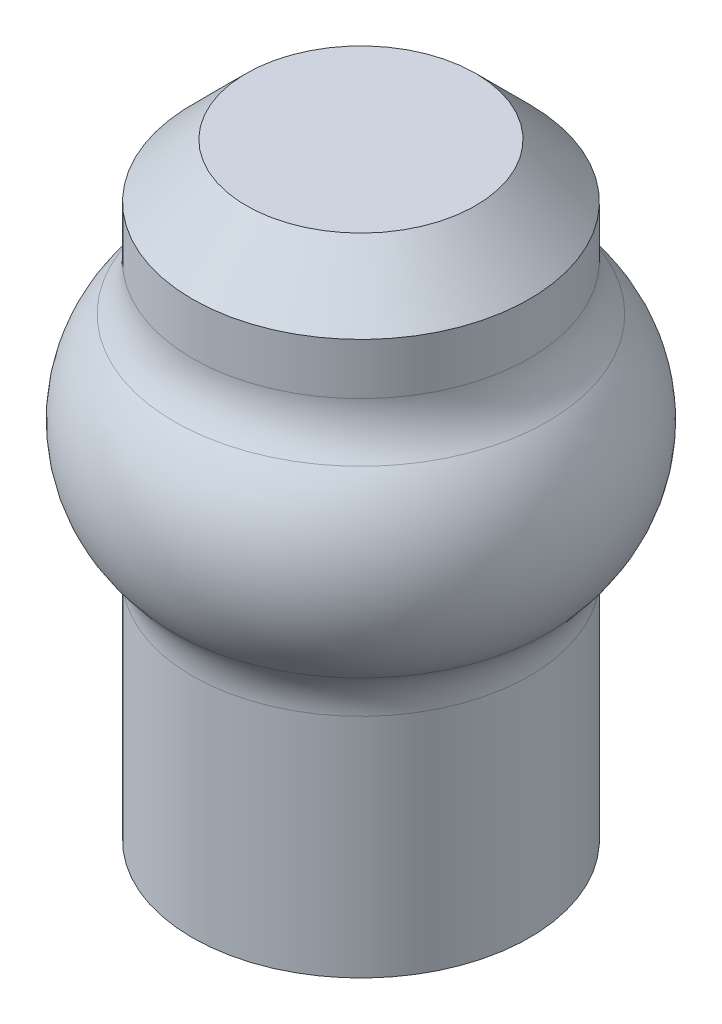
SolidWorks part; units mm, degrees
ref_plane "Front" through (0, 0, 0) normal (0, 0, 1) x (1, 0, 0)
ref_plane "Top" through (0, 0, 0) normal (0, 1, 0) x (1, 0, 0)
ref_plane "Right" through (0, 0, 0) normal (1, 0, 0) x (0, 0, -1)
sketch "Sketch1" plane through (0, 0, 0) normal (0, 0, 1) x (1, 0, 0)
  line L0 (0, 0) -> (0, 66.01) construction
  line L1 (-12.5, 37.198) -> (-12.5, 45)
  line L2 (0, 0) -> (-12.5, 0)
  line L3 (0, 0) -> (0, 45)
  line L4 (0, 45) -> (-12.5, 45)
  line L5 (-12.5, 0) -> (-12.5, 16.802)
  arc A0 (-13.8333, 33.7987) -> (-13.8333, 20.2013) centre (-6.5, 27) ccw
  arc A1 (-12.5, 37.198) -> (-13.8333, 33.7987) centre (-17.5, 37.198) cw
  arc A2 (-12.5, 16.802) -> (-13.8333, 20.2013) centre (-17.5, 16.802) ccw
  point P11 (-12.5, 35)
  point P14 (-12.5, 19)
  dimension "D6" = 5
  dimension "D1" = 45
  dimension "D2" = 10
  dimension "D3" = 16
  dimension "D4" = 4
  dimension "D5" = 25
revolve "Hub" add sketch "Sketch1" angle 360 about L0
chamfer "Chamfer1" distance 4 angle 45 1 edges at (0, 45, -12.5)
